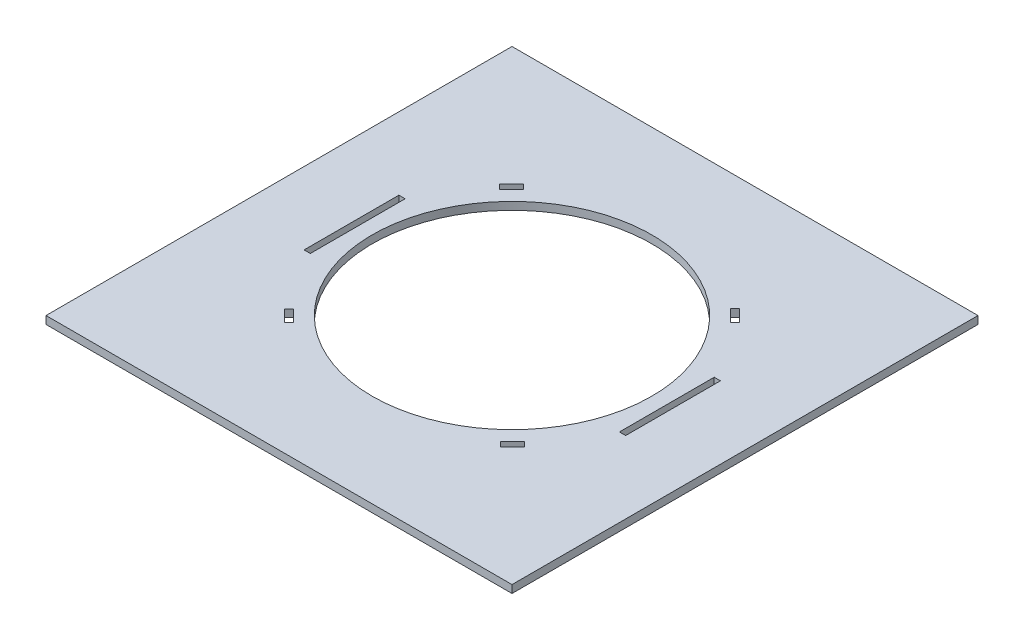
SolidWorks part; units mm, degrees
ref_plane "Front Plane" through (0, 0, 0) normal (0, 0, 1) x (1, 0, 0)
ref_plane "Top Plane" through (0, 0, 0) normal (0, 1, 0) x (1, 0, 0)
ref_plane "Right Plane" through (0, 0, 0) normal (1, 0, 0) x (0, 0, -1)
sketch "Sketch1" plane through (0, 0, 0) normal (0, 1, 0) x (1, 0, 0)
  line L0 (-150, -150) -> (150, 150) construction
  line L1 (-150, 150) -> (150, 150)
  line L2 (-150, 150) -> (-150, -150)
  line L3 (-150, -150) -> (150, -150)
  line L4 (150, 150) -> (150, -150)
  circle A0 centre (0, 0) radius 90
  point P8 (0, 0)
  dimension "D1" = 180
  dimension "D2" = 300
extrude "Boss-Extrude1" add sketch "Sketch1" along normal blind 5
tab and slot "Tab and Slot-Slot1"
pattern_circular "CirPattern1" count 4 over 360 about axis through (0, 0, 0) along (0, 1, 0) of "Tab and Slot-Slot1"
tab and slot "Tab and Slot-Slot2"
ref_plane "Plane1" through (0, 0, 0) normal (1, 0, 0) x (0, 0, -1)
mirror "Mirror1" about plane through (0, 0, 0) normal (1, 0, 0) of "Tab and Slot-Slot2"
